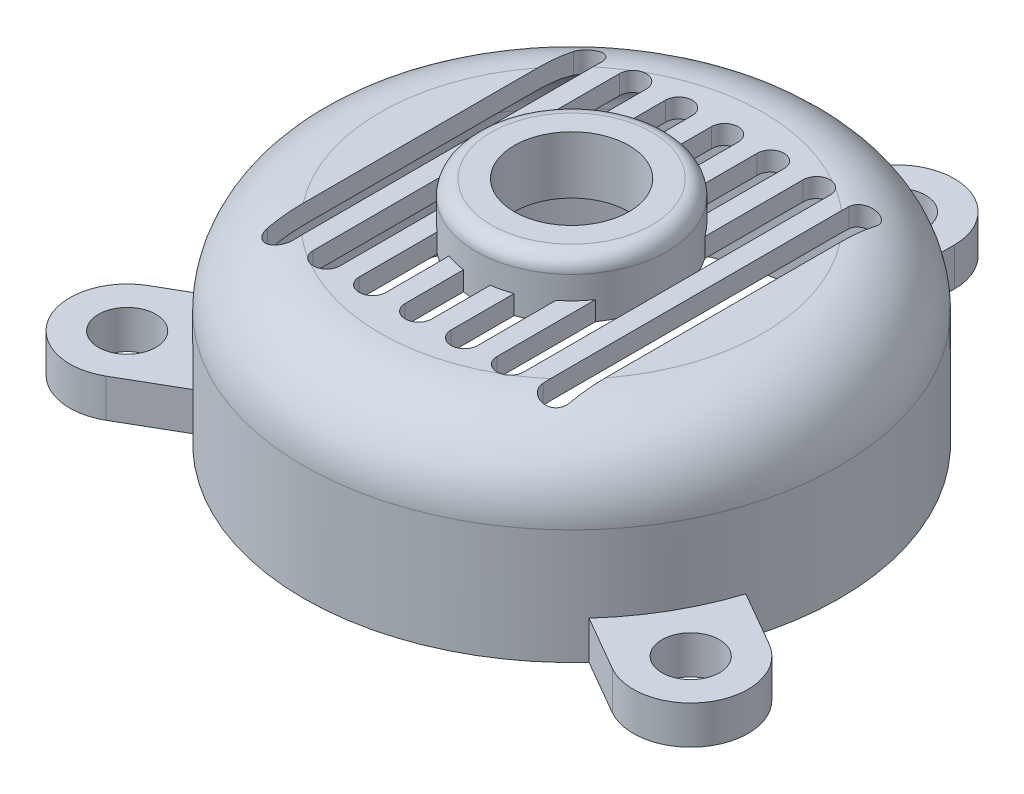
SolidWorks part; units mm, degrees
ref_plane "Front" through (0, 0, 0) normal (0, 0, 1) x (1, 0, 0)
ref_plane "Top" through (0, 0, 0) normal (0, 1, 0) x (1, 0, 0)
ref_plane "Right" through (0, 0, 0) normal (1, 0, 0) x (0, 0, -1)
sketch "Sketch1" plane through (0, 0, 0) normal (0, 0, 1) x (1, 0, 0)
  line L0 (0, 0) -> (0, 33.76) construction
  line L2 (0, 0) -> (35, 0)
  line L3 (0, 0) -> (0, 25)
  line L4 (0, 25) -> (25, 25)
  line L5 (35, 0) -> (35, 15)
  arc A0 (25, 25) -> (35, 15) centre (25, 15) cw
  point P8 (35, 25)
  dimension "D3" = 10
  dimension "D1" = 70
  dimension "D2" = 25
revolve "Revolve1" add sketch "Sketch1" angle 360 about L0
shell "Shell1" thickness 2.5
sketch "Sketch2" plane through (0, 0, 0) normal (0, 1, 0) x (1, 0, 0)
  line L0 (0, 0) -> (0, 44.1208) construction
  line L1 (-7.5, 34.187) -> (-7.5, 42.5)
  line L2 (7.5, 42.5) -> (7.5, 34.187)
  circle A0 centre (0, 0) radius 35 construction
  arc A1 (7.5, 34.187) -> (-7.5, 34.187) centre (0, 0) ccw
  arc A2 (-7.5, 42.5) -> (7.5, 42.5) centre (0, 42.5) cw
  circle A3 centre (0, 42.5) radius 3.75
  dimension "D2" = 7.5
  dimension "D3" = 7.5
  dimension "D1" = 42.5
extrude "Extrude1" add sketch "Sketch2" along normal blind 5
pattern_circular "CirPattern1" count 3 over 360 about axis through (0, 0, 0) along (0, 1, 0)
sketch "Sketch3" plane through (0, 25, 0) normal (0, 1, 0) x (-1, 0, 0)
  line L2 (-16.25, -20) -> (-16.25, 20)
  line L4 (-19.75, -20) -> (-19.75, 20)
  arc A0 (-16.25, -20) -> (-19.75, -20) centre (-18, -20) cw
  arc A1 (-16.25, 20) -> (-19.75, 20) centre (-18, 20) ccw
  dimension "D2" = 3.5
  dimension "D1" = 40
  dimension "D3" = 20
  dimension "D4" = 18
extrude "Cut-Extrude1" cut sketch "Sketch3" against normal through all
pattern_linear "LPattern1" count 7 spacing 6
sketch "Sketch4" plane through (0, 22.5, 0) normal (0, 1, 0) x (-1, 0, 0)
  circle A0 centre (0, 0) radius 12.5
  dimension "D1" = 25
extrude "Extrude2" add sketch "Sketch4" along normal blind 7.5
sketch "Sketch5" plane through (0, 30, 0) normal (0, 1, 0) x (-1, 0, 0)
  point P0 (0, 0)
other "Hole1"
sketch "Sketch6" plane through (0, 30, 0) normal (0, 1, 0) x (-1, 0, 0)
  circle A0 centre (0, 0) radius 7.5
  dimension "D1" = 15
fillet "Fillet1" radius 2
